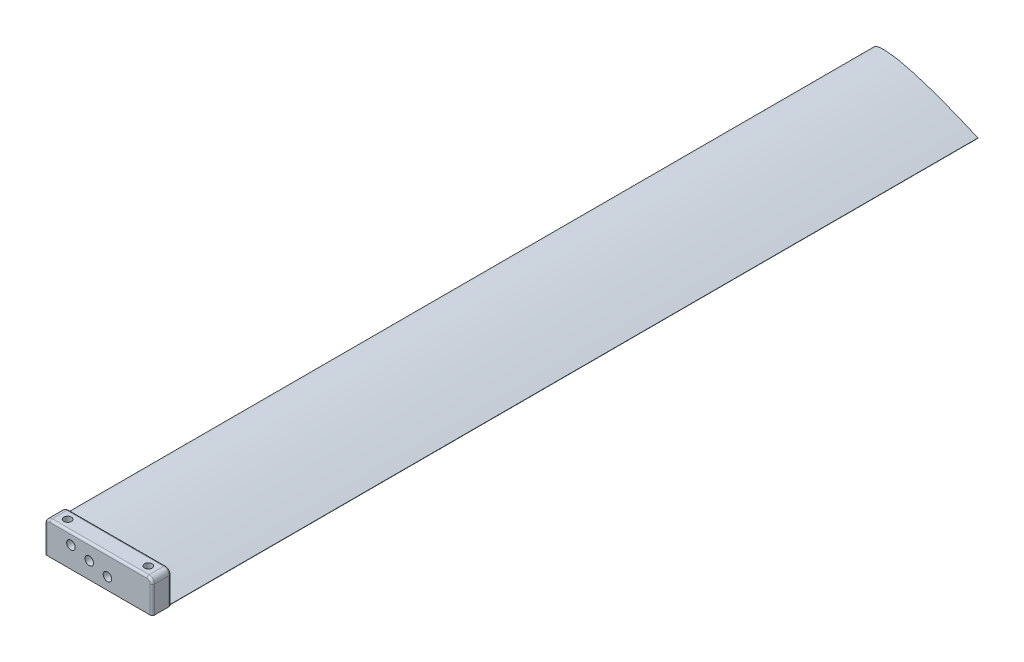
SolidWorks part; units mm, degrees
ref_plane "Front Plane" through (0, 0, 0) normal (0, 0, 1) x (1, 0, 0)
ref_plane "Top Plane" through (0, 0, 0) normal (0, 1, 0) x (1, 0, 0)
ref_plane "Right Plane" through (0, 0, 0) normal (1, 0, 0) x (0, 0, -1)
curve "Curve1"
sketch "Sketch14" plane through (0, 0, 0) normal (0, 0, 1) x (1, 0, 0)
  arc A0 (49.3104, -12.2118) -> (49.2716, -12.3675) centre (49.291, -12.2896) cw
  spline S0 degree 3 poles (1013.8948, 1736.315) (152.4583, -87.3855) (104.6437, -35.7578) (43.8001, -9.8303) (39.8446, -8.204) (35.0751, -6.333) (30.285, -4.5471) (25.4694, -2.863) (20.6201, -1.3105) (16.5369, -0.1715) (13.2378, 0.6034) (10.7401, 1.0967) (8.2109, 1.4781) (6.0721, 1.6624) (4.332, 1.6814) (2.987, 1.6007) (1.8199, 1.3867) (0.7219, 0.9924) (-0.2835, 0.0707) (0.1715, -1.2151) (0.9559, -2.0788) (1.8859, -2.8157) (3.0355, -3.5183) (4.5808, -4.3185) (6.5559, -5.1598) (8.9681, -6.0105) (11.405, -6.7476) (14.6817, -7.6122) (18.8217, -8.5235) (23.8322, -9.4293) (28.8748, -10.2031) (33.9427, -10.8751) (39.0322, -11.4622) (43.2883, -11.8832) (109.1829, -17.555) (175.6391, 5.5812) (80.071, -2009.0445) knots -1.802366 -1.802366 -1.802366 -1.802366 0.024684 0.04933 0.098522 0.147602 0.196578 0.24545 0.294219 0.342904 0.367241 0.391608 0.416059 0.440726 0.453243 0.466028 0.479473 0.486972 0.5 0.513028 0.520527 0.533972 0.546757 0.559274 0.583941 0.608392 0.632759 0.657096 0.705781 0.75455 0.803422 0.852398 0.901478 0.95067 0.975316 2.802387 2.802387 2.802387 2.802387 only from (49.3104, -12.2118) to (49.2716, -12.3675) construction
  spline S1 degree 3 poles (49.3104, -12.2118) (48.5244, -11.8657) (46.9536, -11.1741) (43.8001, -9.8303) (39.8446, -8.204) (35.0751, -6.333) (30.285, -4.5471) (25.4694, -2.863) (20.6201, -1.3105) (16.5369, -0.1715) (13.2378, 0.6034) (10.7401, 1.0967) (8.2109, 1.4781) (6.0721, 1.6624) (4.332, 1.6814) (2.987, 1.6007) (1.8199, 1.3867) (0.7219, 0.9924) (-0.2835, 0.0707) (0.1715, -1.2151) (0.9559, -2.0788) (1.8859, -2.8157) (3.0355, -3.5183) (4.5808, -4.3185) (6.5559, -5.1598) (8.9681, -6.0105) (11.405, -6.7476) (14.6817, -7.6122) (18.8217, -8.5235) (23.8322, -9.4293) (28.8748, -10.2031) (33.9427, -10.8751) (39.0322, -11.4622) (43.2883, -11.8832) (46.7035, -12.1772) (48.4151, -12.304) (49.2716, -12.3675) knots 0 0 0 0 0.024684 0.04933 0.098522 0.147602 0.196578 0.24545 0.294219 0.342904 0.367241 0.391608 0.416059 0.440726 0.453243 0.466028 0.479473 0.486972 0.5 0.513028 0.520527 0.533972 0.546757 0.559274 0.583941 0.608392 0.632759 0.657096 0.705781 0.75455 0.803422 0.852398 0.901478 0.95067 0.975316 1 1 1 1
sketch "Sketch2" plane through (0, 0, 0) normal (0, 0, 1) x (1, 0, 0)
  line L1 (-1.27, 2.54) -> (49.53, 2.54)
  line L2 (-1.27, 2.54) -> (-1.27, -12.7)
  line L3 (-1.27, -12.7) -> (49.53, -12.7)
  line L4 (49.53, 2.54) -> (49.53, -12.7)
  dimension "D1" = 15.24
  dimension "D2" = 50.8
  dimension "D3" = 1.27
  dimension "D4" = 2.54
extrude "Boss-Extrude2" add sketch "Sketch2" along normal blind 8.89 contours L1 L4 L3 L2
sketch "Sketch3" plane through (0, 2.54, 0) normal (0, 1, 0) x (1, 0, 0)
  line L1 (49.53, -8.89) -> (49.53, 0) construction
  line L4 (-1.27, 0) -> (49.53, 0) construction
  circle A0 centre (43.18, -4.445) radius 1.7907
  circle A1 centre (5.08, -4.445) radius 1.7907
  point P2 (49.53, -4.445)
  point P6 (24.13, -4.445)
  point P9 (24.13, 0)
  dimension "D2" = 3.5814
  dimension "D3" = 3.5814
  dimension "D1" = 19.05
  dimension "D4" = 19.05
extrude "Cut-Extrude1" cut sketch "Sketch3" against normal through all
sketch "Sketch6" plane through (0, 0, 0) normal (0, 0, -1) x (-1, 0, 0)
  spline S1 degree 3 poles (4.287, -1.4019) (-2.6366, 4.1578) (-14.9598, 1.4425) (-29.79, 1.0254) (-42.6289, -4.8069) (-50.4798, -8.7244) (-50.5734, -14.6499) (-44.5319, -14.0074) (-38.3759, -13.9584) (-26.0616, -12.9549) (-13.2969, -13.5102) (-1.1878, -10.231) (4.287, -1.4019) (-2.6366, 4.1578) (-14.9598, 1.4425) knots -0.194029 -0.120897 -0.042291 0 0.070504 0.265505 0.372281 0.442858 0.459946 0.501537 0.553693 0.63686 0.805971 0.879103 0.957709 1 1.070504 1.265505 1.372281 only from (-1.6773, 2.7378) to (-1.6773, 2.7378)
ref_plane "Plane2" [suppressed] through (0, 0, -12.7) normal (0, 0, -1) x (-1, 0, 0)
sketch "Sketch7" [suppressed] plane through (0, 0, -12.7) normal (0, 0, -1) x (-1, 0, 0)
  arc A0 (-49.2716, -12.3675) -> (-49.3104, -12.2118) centre (46.7316, 11.6519) cw
  spline S0 degree 3 poles (-80.0711, -2009.0433) (-175.6391, 5.5812) (-109.1829, -17.555) (-43.2883, -11.8832) (-39.0322, -11.4622) (-33.9427, -10.8751) (-28.8748, -10.2031) (-23.8322, -9.4293) (-18.8217, -8.5235) (-14.6817, -7.6122) (-11.405, -6.7476) (-8.9681, -6.0105) (-6.5559, -5.1598) (-4.5808, -4.3185) (-3.0355, -3.5183) (-1.8859, -2.8157) (-0.9559, -2.0788) (-0.1715, -1.2151) (0.2835, 0.0707) (-0.7219, 0.9924) (-1.8199, 1.3867) (-2.987, 1.6007) (-4.332, 1.6814) (-6.0721, 1.6624) (-8.2109, 1.4781) (-10.7401, 1.0967) (-13.2378, 0.6034) (-16.5369, -0.1715) (-20.6201, -1.3105) (-25.4694, -2.863) (-30.285, -4.5471) (-35.0751, -6.333) (-39.8446, -8.204) (-43.8001, -9.8303) (-104.6429, -35.7575) (-152.457, -87.384) (-1013.8577, 1736.2365) knots -1.802386 -1.802386 -1.802386 -1.802386 0.024684 0.04933 0.098522 0.147602 0.196578 0.24545 0.294219 0.342904 0.367241 0.391608 0.416059 0.440726 0.453243 0.466028 0.479473 0.486972 0.5 0.513028 0.520527 0.533972 0.546757 0.559274 0.583941 0.608392 0.632759 0.657096 0.705781 0.75455 0.803422 0.852398 0.901478 0.95067 0.975316 2.80234 2.80234 2.80234 2.80234 only from (-49.2716, -12.3675) to (-49.3104, -12.2118) construction
  spline S1 degree 3 poles (-49.2716, -12.3675) (-48.4151, -12.304) (-46.7035, -12.1772) (-43.2883, -11.8832) (-39.0322, -11.4622) (-33.9427, -10.8751) (-28.8748, -10.2031) (-23.8322, -9.4293) (-18.8217, -8.5235) (-14.6817, -7.6122) (-11.405, -6.7476) (-8.9681, -6.0105) (-6.5559, -5.1598) (-4.5808, -4.3185) (-3.0355, -3.5183) (-1.8859, -2.8157) (-0.9559, -2.0788) (-0.1715, -1.2151) (0.2835, 0.0707) (-0.7219, 0.9924) (-1.8199, 1.3867) (-2.987, 1.6007) (-4.332, 1.6814) (-6.0721, 1.6624) (-8.2109, 1.4781) (-10.7401, 1.0967) (-13.2378, 0.6034) (-16.5369, -0.1715) (-20.6201, -1.3105) (-25.4694, -2.863) (-30.285, -4.5471) (-35.0751, -6.333) (-39.8446, -8.204) (-43.8001, -9.8303) (-46.9536, -11.1741) (-48.5244, -11.8657) (-49.3104, -12.2118) knots 0 0 0 0 0.024684 0.04933 0.098522 0.147602 0.196578 0.24545 0.294219 0.342904 0.367241 0.391608 0.416059 0.440726 0.453243 0.466028 0.479473 0.486972 0.5 0.513028 0.520527 0.533972 0.546757 0.559274 0.583941 0.608392 0.632759 0.657096 0.705781 0.75455 0.803422 0.852398 0.901478 0.95067 0.975316 1 1 1 1
loft "Loft1" [suppressed] add profiles "Sketch6", "Sketch7"
ref_plane "Plane3" through (0, 0, -25.4) normal (0, 0, -1) x (-1, 0, 0)
ref_plane "Plane4" through (0, 0, -381) normal (0, 0, -1) x (-1, 0, 0)
sketch "Sketch1" plane through (0, 0, -381) normal (0, 0, 1) x (1, 0, 0)
  arc A0 (49.3104, -12.2118) -> (49.2716, -12.3675) centre (48.9108, -12.1948) cw
  spline S0 degree 3 poles (1855.4421, 3550.5217) (176.0162, -115.3229) (119.7027, -42.1749) (43.8001, -9.8303) (39.8446, -8.204) (35.0751, -6.333) (30.285, -4.5471) (25.4694, -2.863) (20.6201, -1.3105) (16.5369, -0.1715) (13.2378, 0.6034) (10.7401, 1.0967) (8.2109, 1.4781) (6.0721, 1.6624) (4.332, 1.6814) (2.987, 1.6007) (1.8199, 1.3867) (0.7219, 0.9924) (-0.2835, 0.0707) (0.1715, -1.2151) (0.9559, -2.0788) (1.8859, -2.8157) (3.0355, -3.5183) (4.5808, -4.3185) (6.5559, -5.1598) (8.9681, -6.0105) (11.405, -6.7476) (14.6817, -7.6122) (18.8217, -8.5235) (23.8322, -9.4293) (28.8748, -10.2031) (33.9427, -10.8751) (39.0322, -11.4622) (43.2883, -11.8832) (125.4919, -18.9588) (209.5553, 19.1881) (-28.5999, -4005.9262) knots -2.272842 -2.272842 -2.272842 -2.272842 0.024684 0.04933 0.098522 0.147602 0.196578 0.24545 0.294219 0.342904 0.367241 0.391608 0.416059 0.440726 0.453243 0.466028 0.479473 0.486972 0.5 0.513028 0.520527 0.533972 0.546757 0.559274 0.583941 0.608392 0.632759 0.657096 0.705781 0.75455 0.803422 0.852398 0.901478 0.95067 0.975316 3.272863 3.272863 3.272863 3.272863 only from (49.3104, -12.2118) to (49.2716, -12.3675) construction
  spline S1 degree 3 poles (49.3104, -12.2118) (48.5244, -11.8657) (46.9536, -11.1741) (43.8001, -9.8303) (39.8446, -8.204) (35.0751, -6.333) (30.285, -4.5471) (25.4694, -2.863) (20.6201, -1.3105) (16.5369, -0.1715) (13.2378, 0.6034) (10.7401, 1.0967) (8.2109, 1.4781) (6.0721, 1.6624) (4.332, 1.6814) (2.987, 1.6007) (1.8199, 1.3867) (0.7219, 0.9924) (-0.2835, 0.0707) (0.1715, -1.2151) (0.9559, -2.0788) (1.8859, -2.8157) (3.0355, -3.5183) (4.5808, -4.3185) (6.5559, -5.1598) (8.9681, -6.0105) (11.405, -6.7476) (14.6817, -7.6122) (18.8217, -8.5235) (23.8322, -9.4293) (28.8748, -10.2031) (33.9427, -10.8751) (39.0322, -11.4622) (43.2883, -11.8832) (46.7035, -12.1772) (48.4151, -12.304) (49.2716, -12.3675) knots 0 0 0 0 0.024684 0.04933 0.098522 0.147602 0.196578 0.24545 0.294219 0.342904 0.367241 0.391608 0.416059 0.440726 0.453243 0.466028 0.479473 0.486972 0.5 0.513028 0.520527 0.533972 0.546757 0.559274 0.583941 0.608392 0.632759 0.657096 0.705781 0.75455 0.803422 0.852398 0.901478 0.95067 0.975316 1 1 1 1
  dimension "D1" = 0.4
loft "Loft4" add profiles "Sketch1", "Sketch14"
sketch "Sketch13" plane through (0, 0, 8.89) normal (0, 0, 1) x (1, 0, 0)
  line L0 (0, 0) -> (27.7904, -6.9289) construction
  line L1 (0, 0) -> (4.0798, 0) construction
  circle A0 centre (11.0905, -2.7652) radius 2
  circle A1 centre (19.7265, -4.8751) radius 2
  circle A2 centre (28.3277, -7.1224) radius 2
  dimension "D1" = 4
  dimension "D2" = 4
  dimension "D3" = 4
  dimension "D4" = 8.89
  dimension "D5" = 8.89
  dimension "D6" = 14
  dimension "D7" = 11.43
extrude "Cut-Extrude2" cut sketch "Sketch13" against normal blind 44.45
fillet "Fillet1" radius 2.54 2 edges at (-1.27, 2.54, 4.445) (49.53, 2.54, 4.445)
fillet "Fillet2" radius 1.016 10 edges at (-1.27, -6.35, 0) (-0.5261, 1.7961, 0) (24.13, 2.54, 0) (48.7861, 1.7961, 0) (-1.27, -6.35, 8.89) (-0.5261, 1.7961, 8.89) (24.13, 2.54, 8.89) (48.7861, 1.7961, 8.89) (49.53, -6.35, 0) (49.53, -6.35, 8.89)
